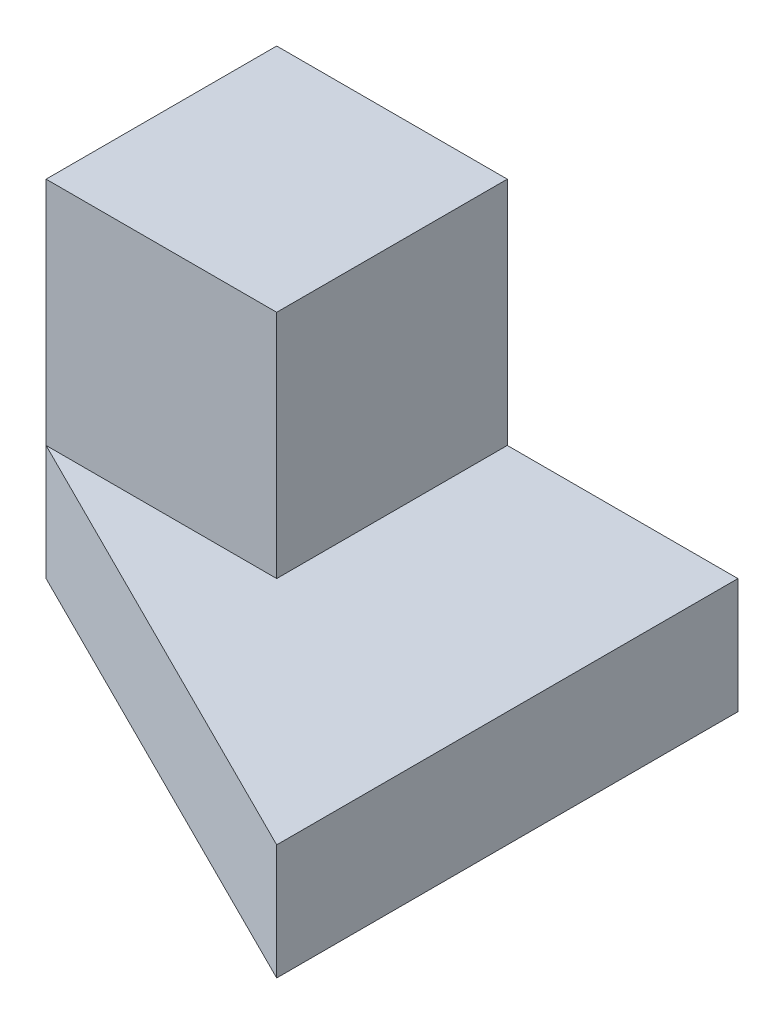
SolidWorks part; units mm, degrees
ref_plane "Front Plane" through (0, 0, 0) normal (0, 0, 1) x (1, 0, 0)
ref_plane "Top Plane" through (0, 0, 0) normal (0, 1, 0) x (1, 0, 0)
ref_plane "Right Plane" through (0, 0, 0) normal (1, 0, 0) x (0, 0, -1)
sketch "Sketch1" plane through (0, 0, 0) normal (0, 1, 0) x (1, 0, 0)
  line L0 (0, 0) -> (0, 20)
  line L1 (0, 20) -> (40, 20)
  line L2 (40, 20) -> (40, -20)
  line L3 (40, -20) -> (0, 0)
  dimension "D1" = 40
  dimension "D2" = 20
  dimension "D3" = 40
extrude "Extrude1" add sketch "Sketch1" along normal blind 10 contours L3 L2 L1 L0
sketch "Sketch2" plane through (0, 10, 0) normal (0, 1, 0) x (1, 0, 0)
  line L0 (0, 20) -> (40, 20) construction
  line L1 (0, 0) -> (20, 0)
  line L2 (0, 0) -> (0, 20)
  line L3 (0, 20) -> (20, 20)
  line L4 (20, 0) -> (20, 20)
  dimension "D1" = 20
extrude "Extrude2" add sketch "Sketch2" along normal blind 20
